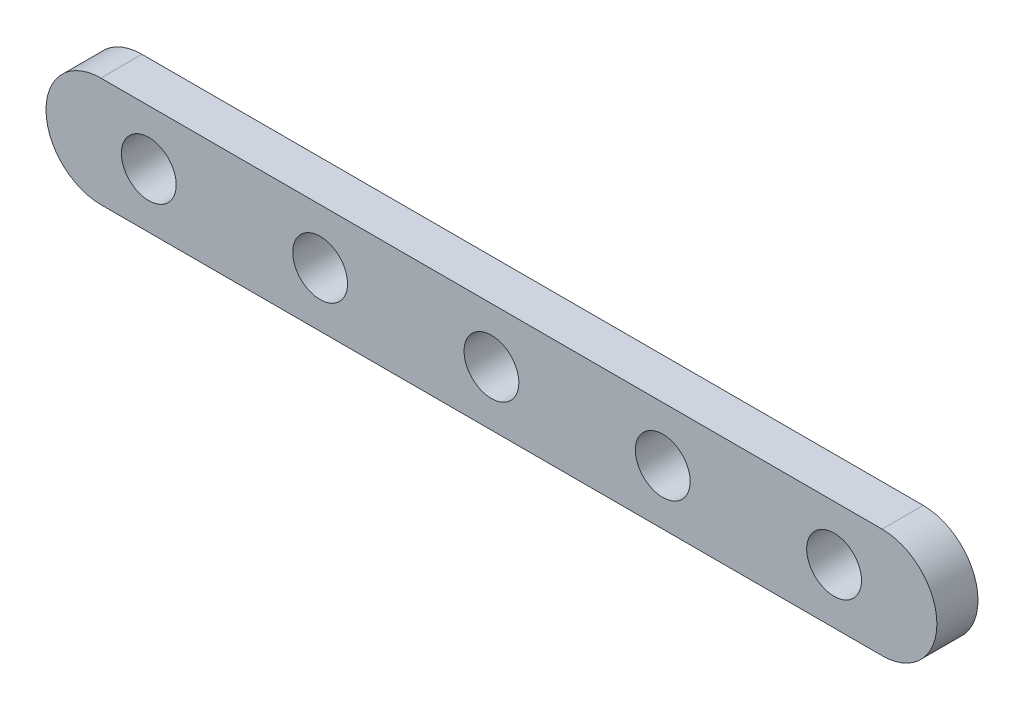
SolidWorks part; units mm, degrees
ref_plane "Plan1" through (0, 0, 0) normal (0, 0, 1) x (1, 0, 0)
ref_plane "Plan2" through (0, 0, 0) normal (0, 1, 0) x (1, 0, 0)
ref_plane "Plan3" through (0, 0, 0) normal (1, 0, 0) x (0, 0, -1)
sketch "Esquisse1" plane through (0, 0, 0) normal (0, 0, 1) x (1, 0, 0)
  line L0 (-28.5, 4) -> (28.5, 4)
  line L1 (0, 21.3841) -> (0, -26.9672) construction
  line L2 (28.5, -4) -> (-28.5, -4)
  arc A0 (-28.5, 4) -> (-28.5, -4) centre (-28.5, 0) ccw
  arc A1 (28.5, 4) -> (28.5, -4) centre (28.5, 0) cw
  circle A2 centre (-25, 0) radius 2
  circle A3 centre (-12.5, 0) radius 2
  circle A4 centre (0, 0) radius 2
  circle A5 centre (12.5, 0) radius 2
  circle A6 centre (25, 0) radius 2
  dimension "D3" = 4
  dimension "D5" = 12.5
  dimension "D6" = 12.5
  dimension "D7" = 12.5
  dimension "D8" = 28.5
  dimension "D9" = 12.5
  dimension "D1" = 8
  dimension "D2" = 28.5
  dimension "D4" = 4
extrude "Base-Extrusion" add sketch "Esquisse1" along normal blind 3
